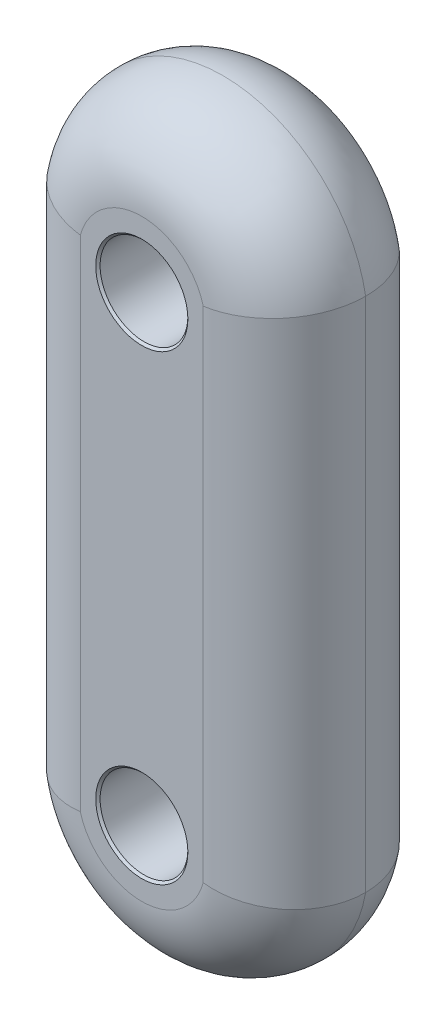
SolidWorks part; units mm, degrees
ref_plane "Спереди" through (0, 0, 0) normal (0, 0, 1) x (1, 0, 0)
ref_plane "Сверху" through (0, 0, 0) normal (0, 1, 0) x (1, 0, 0)
ref_plane "Справа" through (0, 0, 0) normal (1, 0, 0) x (0, 0, -1)
sketch "Эскиз1" plane through (0, 0, 0) normal (0, 0, 1) x (1, 0, 0)
  line L0 (0, 52.5945) -> (0, 0) construction
  line L1 (0, 0) -> (0, -52.5945) construction
  line L2 (-32.5, 58.8173) -> (-32.5, -58.8173)
  line L3 (32.5, 58.8173) -> (32.5, -58.8173)
  line L4 (0, 0) -> (32.5, 0) construction
  line L5 (0, 0) -> (-32.5, 0) construction
  circle A0 centre (0, 52.5945) radius 10 construction
  circle A1 centre (0, -52.5945) radius 10 construction
  arc A4 (32.5, 58.8173) -> (-32.5, 58.8173) centre (0, 53.0945) ccw
  arc A5 (32.5, -58.8173) -> (-32.5, -58.8173) centre (0, -53.0945) cw
  dimension "D1" = 65
  dimension "D2" = 20
  dimension "D4" = 33
  dimension "D3" = 105.189
  dimension "D5" = 106.189
extrude "Бобышка-Вытянуть1" add sketch "Эскиз1" along normal mid plane 37
fillet "Скругление2" radius 18.5 8 edges at (-32.5, 0, -18.5) (0, -86.0945, -18.5) (32.5, 0, -18.5) (0, 86.0945, -18.5) (32.5, 0, 18.5) (0, -86.0945, 18.5) (-32.5, 0, 18.5) (0, 86.0945, 18.5)
sketch "Эскиз2" plane through (0, 0, 0) normal (0, 0, 1) x (1, 0, 0)
  circle A0 centre (0, 52.5945) radius 10 construction
  circle A1 centre (0, 52.5945) radius 10
  circle A2 centre (0, -52.5945) radius 10 construction
  circle A3 centre (0, -52.5945) radius 10
extrude "Вырез-Вытянуть1" cut sketch "Эскиз2" against normal mid plane 37
chamfer "Фаска1" distance 0.5 angle 45 4 edges at (10, -52.5945, 18.5) (10, -52.5945, -18.5) (10, 52.5945, 18.5) (10, 52.5945, -18.5)
